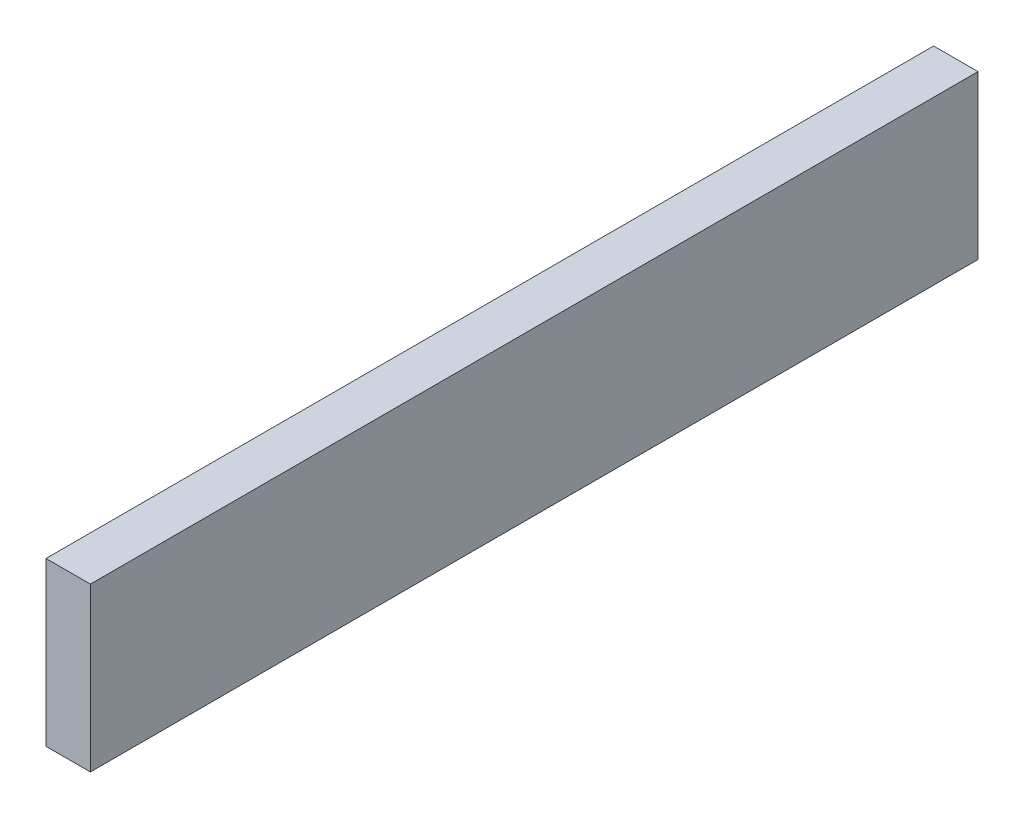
SolidWorks part; units mm, degrees
ref_plane "Front Plane" through (0, 0, 0) normal (0, 0, 1) x (1, 0, 0)
ref_plane "Top Plane" through (0, 0, 0) normal (0, 1, 0) x (1, 0, 0)
ref_plane "Right Plane" through (0, 0, 0) normal (1, 0, 0) x (0, 0, -1)
sketch "Sketch2" plane through (0, 0, 0) normal (0, 0, 1) x (1, 0, 0)
  line L1 (0, 0) -> (38.1, 0)
  line L2 (0, 0) -> (0, 139.7)
  line L3 (0, 139.7) -> (38.1, 139.7)
  line L4 (38.1, 0) -> (38.1, 139.7)
  line L5 (0, 0) -> (38.1, 139.7) construction
  line L6 (0, 139.7) -> (38.1, 0) construction
  point P4 (19.05, 69.85)
extrude "Boss-Extrude2" add sketch "Sketch2" along normal blind 762
equation "\"system_width\"= 7ft + 10 "
equation "\"system_length\"= 95.5"
equation "\"module_board_length\"= 11.25in"
equation "\"module_board_width\"= 1.5in"
equation "\"module_width\"= (\"system_width\" -  2* \"module_trim_thickness\") / 2"
equation "\"module_length\"= (\"system_top_length\" - \"module_trim_thickness\")/ 2"
equation "\"module_board_long_depth\"= \"module_length\" - \"module_lip_width\""
equation "\"module_board_short_depth\"= \"module_width\" - ( 2 * \"module_board_width\" ) - \"module_lip_width\""
equation "\"D1@Sketch2\"=\"step_board_length\""
equation "\"D2@Sketch2\"=\"step_board_width\""
equation "\"D1@Boss-Extrude2\"=\"step_module_length\" - 3*\"step_board_width\""
equation "\"module_board_hole\"= 0.5in"
equation "\"module_board_hole_position\"= ( ( \"module_width\" - \"module_board_hole_seperation\" ) / 2 ) + \"module_board_width\"/2"
equation "\"module_board_hole_seperation\"= 20in"
equation "\"system_step_width\"= 3ft"
equation "\"system_top_length\"= \"system_length\" - \"system_step_length\""
equation "\"module_top_thickness\"= 0.75in"
equation "\"module_lip_width\"= 1.5in"
equation "\"module_trim_thickness\"= 1in"
equation "\"module_trim_height\"= 14in"
equation "\"module_top_length\"= \"module_length\" + \"module_lip_width\""
equation "\"module_top_width\"= \"module_width\" + \"module_lip_width\""
equation "\"step_board_length\"= 5.5in"
equation "\"step_board_width\"= 1.5in"
equation "\"system_step_length\"= 2ft+11.5"
equation "\"module_top_overhang\"= 4.5in"
equation "\"module_trim_angle\"= 45deg"
equation "\"step_module_width\"= \"module_width\""
equation "\"step_module_length\"= \"system_step_length\" - \"module_trim_thickness\""
equation "\"step_board_short_depth\"= \"step_module_length\" - \"module_lip_width\""
equation "\"step_board_long_depth\"= \"step_module_width\" - (2 * \"module_board_width\") - \"module_lip_width\""
